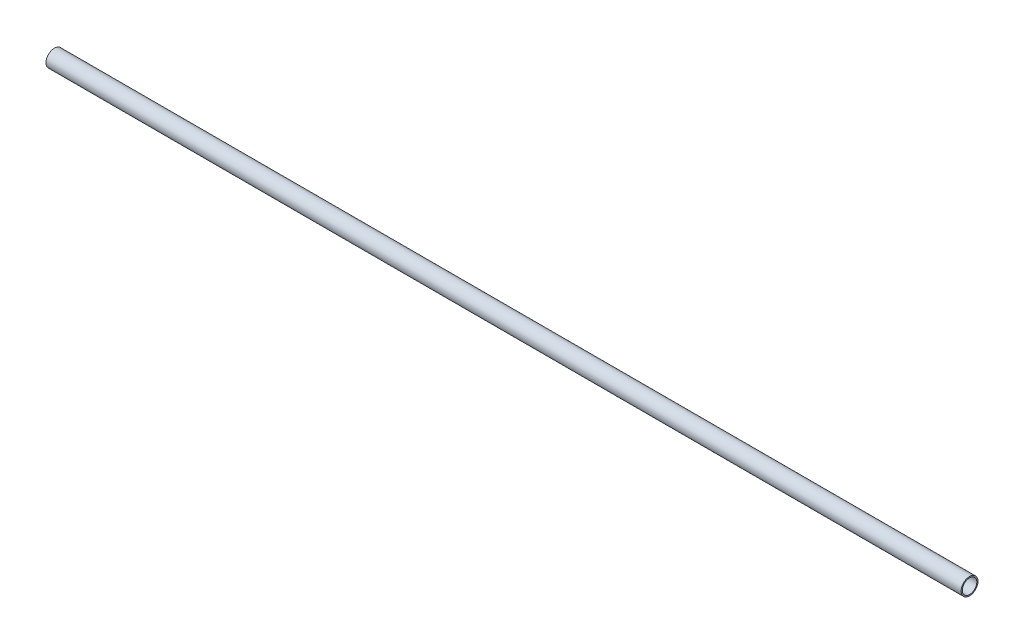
SolidWorks part; units mm, degrees
ref_plane "Front Plane" through (0, 0, 0) normal (0, 0, 1) x (1, 0, 0)
ref_plane "Top Plane" through (0, 0, 0) normal (0, 1, 0) x (1, 0, 0)
ref_plane "Right Plane" through (0, 0, 0) normal (1, 0, 0) x (0, 0, -1)
sketch "Sketch1" plane through (0, 0, 0) normal (1, 0, 0) x (0, 0, -1)
  circle A0 centre (0, 0) radius 7
  circle A1 centre (0, 0) radius 6
  dimension "D1" = 14
  dimension "D2" = 12
extrude "Boss-Extrude1" add sketch "Sketch1" along normal mid plane 760
